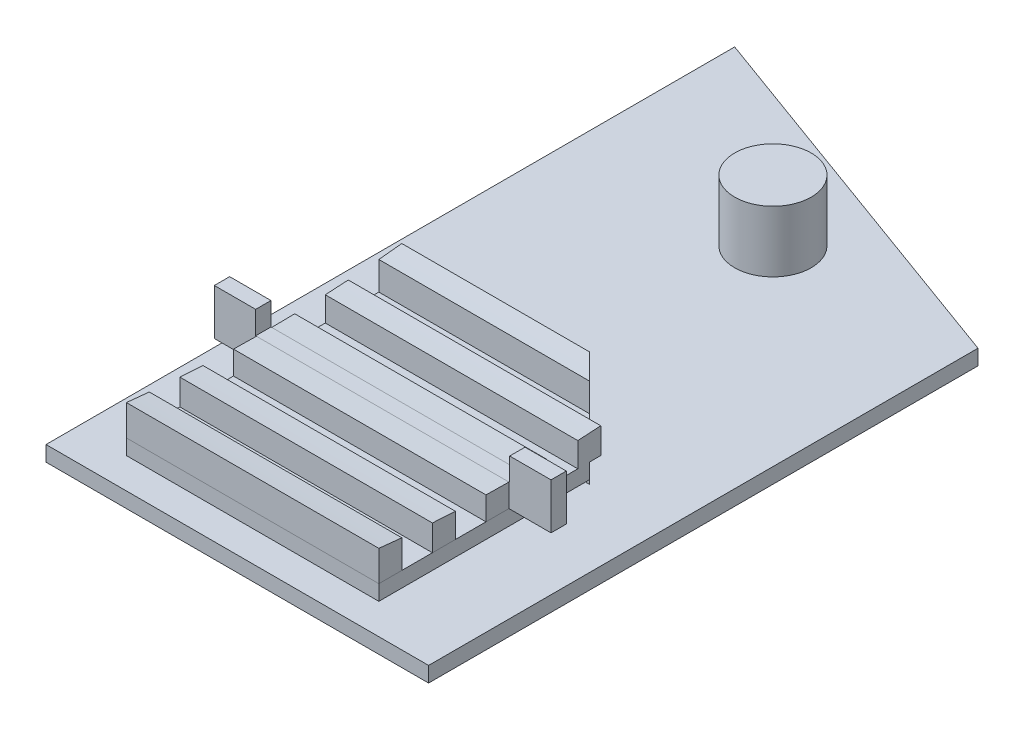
SolidWorks part; units mm, degrees
ref_plane "Plan de face" through (0, 0, 0) normal (0, 0, 1) x (1, 0, 0)
ref_plane "Plan de dessus" through (0, 0, 0) normal (0, 1, 0) x (1, 0, 0)
ref_plane "Plan de droite" through (0, 0, 0) normal (1, 0, 0) x (0, 0, -1)
sketch "Esquisse1" plane through (0, 0, 0) normal (0, 1, 0) x (1, 0, 0)
  line L0 (0, 57.379) -> (0, -18.7628) construction
  line L1 (-23.1709, 0) -> (25.5626, 0) construction
  line L2 (-12.5, 0) -> (12.5, 0)
  line L3 (12.5, 0) -> (12.5, 35.9007)
  line L4 (-12.5, 45) -> (12.5, 35.9007)
  line L5 (-12.5, 45) -> (-12.5, 0)
  point P7 (0, 40)
  dimension "D1" = 25
  dimension "D2" = 70
  dimension "D3" = 45
extrude "Boss.-Extru.1" add sketch "Esquisse1" against normal blind 1
sketch "Esquisse2" plane through (0, 0, 0) normal (0, 1, 0) x (1, 0, 0)
  line L0 (0, 0) -> (0, 62.3097) construction
  line L1 (-8.25, 10) -> (7.5, 10) construction
  line L2 (8.25, 1) -> (-8.25, 1)
  line L3 (8.25, 1) -> (8.25, 17.5)
  line L4 (4, 19) -> (-8.25, 19)
  line L5 (-8.25, 1) -> (-8.25, 19)
  line L6 (8.25, 1) -> (-8.25, 19) construction
  line L7 (6.875, 17.5) -> (-8.25, 1) construction
  line L8 (-8.25, 17.5) -> (5.5, 17.5)
  line L9 (-8.25, 17.5) -> (-8.25, 15.5)
  line L10 (-8.25, 15.5) -> (8.25, 15.5)
  line L11 (8.25, 17.5) -> (8.25, 15.5)
  line L12 (-8.25, 14) -> (8.25, 14)
  line L13 (-8.25, 14) -> (-8.25, 12)
  line L14 (-8.25, 12) -> (8.25, 12)
  line L15 (8.25, 14) -> (8.25, 12)
  line L16 (-8.25, 2.5) -> (8.25, 2.5)
  line L17 (-8.25, 4.5) -> (8.25, 4.5)
  line L18 (-8.25, 6) -> (8.25, 6)
  line L19 (-8.25, 8) -> (8.25, 8)
  line L20 (-8.25, 10.5) -> (8.25, 10.5)
  line L21 (8.25, 10.5) -> (8.25, 9.5)
  line L22 (8.25, 9.5) -> (-8.25, 9.5)
  line L23 (4, 19) -> (5.5, 17.5)
  circle A0 centre (0, 35) radius 2.5
  point P5 (0, 10)
  point P8 (0, 1)
  dimension "D2" = 5
  dimension "D1" = 35
  dimension "D3" = 16.5
  dimension "D4" = 18
  dimension "D5" = 10
  dimension "D6" = 1.5
  dimension "D7" = 2
  dimension "D8" = 1.5
  dimension "D9" = 2
  dimension "D10" = 1.5
  dimension "D11" = 1.5
  dimension "D12" = 45
  dimension "D13" = 4
extrude "Boss.-Extru.2" add sketch "Esquisse2" along normal blind 2 from offset 2 contours A0 | L5 L8 L3 L4 | L5 L12 L3 L10 | L5 L20 L3 L14 | L3 L22 L5 L19 | L18 L5 L17 L3 | L16 L5 L2 L3
sketch "Esquisse3" plane through (-8.25, 0, 0) normal (-1, 0, 0) x (0, 0, 1)
  line L1 (-19, 4) -> (-1, 4)
  spline S0 degree 2 poles (-19, 4) (-10, 3) (-1, 4) knots 0 0 0 1 1 1
  point P2 (-10, 4)
  dimension "D1" = 0.5
  dimension "D2" = 18
extrude "Enlèv. mat.-Extru.1" cut sketch "Esquisse3" against normal through all
sketch "Esquisse4" plane through (0, 0, 0) normal (0, 1, 0) x (1, 0, 0)
  line L0 (8.25, 1) -> (-8.25, 1) construction
  line L1 (8.25, 1) -> (-8.25, 1)
  line L2 (4, 19) -> (-8.25, 19) construction
  line L3 (4, 19) -> (5.5, 17.5) construction
  line L5 (4, 19) -> (-8.25, 19)
  line L7 (4, 19) -> (8.25, 14.75)
  line L10 (-8.25, 19) -> (-8.25, 1)
  line L11 (8.25, 14.75) -> (8.25, 1)
extrude "Boss.-Extru.3" add sketch "Esquisse4" along normal blind 1 from offset 1
sketch "Esquisse5" plane through (0, 2, 0) normal (0, 1, 0) x (1, 0, 0)
  line L7 (8.25, 1) -> (8.25, 14.75)
  line L8 (8.25, 14.75) -> (4, 19)
  line L10 (8.25, 14.75) -> (4, 19)
  line L12 (-8.25, 19) -> (-8.25, 1)
  line L13 (-8.25, 1) -> (8.25, 1)
  line L14 (8.25, 1) -> (8.25, 14.75)
  line L18 (-8.25, 19) -> (-8.25, 1)
  line L19 (-8.25, 1) -> (8.25, 1)
  line L30 (-8.25, 10.5) -> (8.25, 10.5) construction
  line L31 (8.25, 9.5) -> (-8.25, 9.5) construction
  line L32 (-8.25, 10.5) -> (8.25, 10.5)
  line L33 (8.25, 9.5) -> (-8.25, 9.5)
  line L35 (8.25, 10.5) -> (11, 10.5)
  line L36 (8.25, 10.5) -> (8.25, 9.5)
  line L37 (8.25, 9.5) -> (11, 9.5)
  line L38 (11, 10.5) -> (11, 9.5)
  line L39 (-8.25, 10.5) -> (-11, 10.5)
  line L40 (-8.25, 10.5) -> (-8.25, 9.5)
  line L41 (-8.25, 9.5) -> (-11, 9.5)
  line L42 (-11, 10.5) -> (-11, 9.5)
  line L45 (4, 19) -> (-8.25, 19)
  line L46 (4, 19) -> (-8.25, 19)
  dimension "D2" = 2.75
  dimension "D3" = 2.75
  dimension "D1" = 0
extrude "Boss.-Extru.4" add sketch "Esquisse5" along normal blind 3
sketch "Esquisse6" plane through (0, 0, 0) normal (0, 1, 0) x (1, 0, 0)
  line L0 (8.25, 14.75) -> (8.25, 1) construction
  line L1 (8.25, 1) -> (-8.25, 1) construction
  line L2 (-8.25, 1) -> (-8.25, 19) construction
  line L3 (-8.25, 19) -> (4, 19) construction
  line L4 (4, 19) -> (8.25, 14.75) construction
  line L5 (8.25, 14.75) -> (8.25, 1)
  line L6 (8.25, 1) -> (-8.25, 1)
  line L7 (-8.25, 1) -> (-8.25, 19)
  line L8 (-8.25, 19) -> (4, 19)
  line L9 (4, 19) -> (8.25, 14.75)
  line L10 (-8.25, 15.5) -> (7.5, 15.5)
  line L11 (8.25, 15.5) -> (-8.25, 15.5) construction
  circle A0 centre (0, 35) radius 2.5 construction
  circle A1 centre (0, 35) radius 2.5
extrude "Boss.-Extru.6" add sketch "Esquisse6" along normal up to surface (2 mm away) contours L7 L10 L9 L8 | A1
sketch "Esquisse8" plane through (0, 0, 0) normal (1, 0, 0) x (0, 0, -1)
  line L0 (19, 4) -> (10, 6.4187)
  line L1 (1, 4) -> (19, 4)
  line L2 (10, 6.4187) -> (1, 4)
  line L11 (19, 0) -> (19, 4)
  line L12 (15.5, 0) -> (19, 0)
  line L13 (15.5, 1) -> (15.5, 0)
  line L14 (1, 1) -> (15.5, 1)
  line L15 (1, 2) -> (1, 1)
  line L16 (14, 2) -> (1, 2)
  line L17 (14, 3.5988) -> (14, 2)
  line L18 (15.5, 2) -> (15.5, 3.6867)
  line L19 (17.5, 2) -> (15.5, 2)
  line L20 (17.5, 3.8472) -> (17.5, 2)
  line L21 (19, 0) -> (19, 4)
  line L22 (15.5, 0) -> (19, 0)
  line L23 (15.5, 1) -> (15.5, 0)
  line L24 (1, 1) -> (15.5, 1)
  line L25 (1, 2) -> (1, 1)
  line L26 (14, 2) -> (1, 2)
  line L27 (14, 3.5988) -> (14, 2)
  line L28 (15.5, 2) -> (15.5, 3.6867)
  line L29 (17.5, 2) -> (15.5, 2)
  line L30 (17.5, 3.8472) -> (17.5, 2)
  arc A2 (14, 3.5988) -> (15.5, 3.6867) centre (9.9838, 84.9196) ccw
  arc A3 (17.5, 3.8472) -> (19, 4) centre (9.9146, 85.7622) ccw
  arc A4 (14, 3.5988) -> (15.5, 3.6867) centre (9.9838, 84.9196) ccw
  arc A5 (17.5, 3.8472) -> (19, 4) centre (9.9146, 85.7622) ccw
  spline S0 degree 2 poles (1, 4) (10, 3) (19, 4) knots 0 0 0 1 1 1
  point P2 (10, 4)
  dimension "D1" = 0.5
  dimension "D2" = 18
  dimension "D3" = 0
extrude "Enlèv. mat.-Extru.2" cut sketch "Esquisse8" against normal blind 8.3 and the other way blind 8.3 contours L1 S0 A4 A5 | L0 L2 L1
